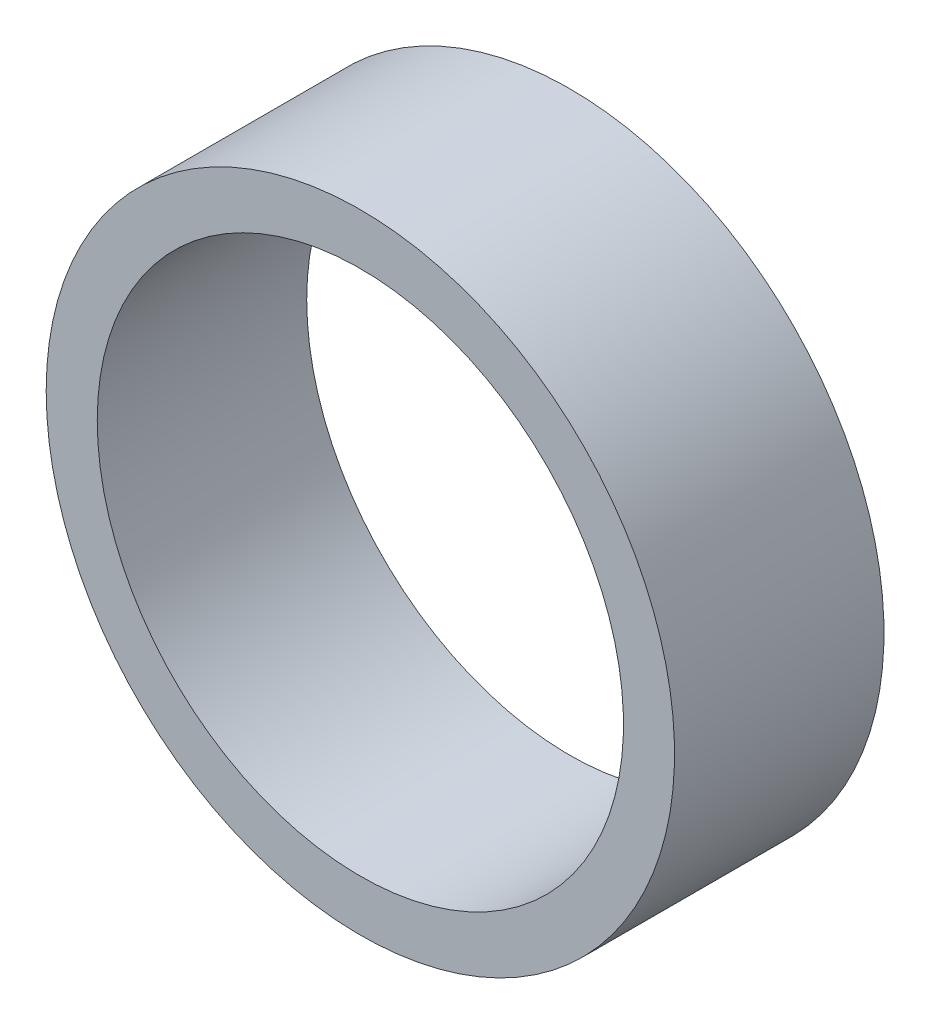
SolidWorks part; units mm, degrees
ref_plane "Front" through (0, 0, 0) normal (0, 0, 1) x (1, 0, 0)
ref_plane "Top" through (0, 0, 0) normal (0, 1, 0) x (1, 0, 0)
ref_plane "Right" through (0, 0, 0) normal (1, 0, 0) x (0, 0, -1)
sketch "Logo3_Revol_Axis" plane through (0, 0, 0) normal (0, 1, 0) x (1, 0, 0)
  line L0 (0, -30.1653) -> (0, 30.1653) construction
sketch "Logo3_bib1" plane through (0, 0, 0) normal (0, -1, 0) x (-1, 0, 0)
  line L0 (9.525, 0) -> (7.977, 0)
  line L1 (7.977, 0) -> (7.977, -6.35)
  line L2 (7.977, -6.35) -> (9.525, -6.35)
  line L3 (8.751, 0) -> (8.751, -6.35) construction
  line L4 (9.525, -6.35) -> (9.525, 0)
  line L5 (9.525, -3.175) -> (7.977, -3.175) construction
  line L10 (0, 38.9764) -> (0, -41.3764) construction
  point P11 (7.977, 0)
  point P15 (7.977, -6.35)
revolve "Revolve1" add sketch "Logo3_bib1" angle 360 about L10
equation "\"D2@Logo3_bib1\"=\"logo3_l1@Logo3_bib1\"/2"
equation "\"D3@Logo3_bib1\"=(\"logo3_d1@Logo3_bib1\"-\"logo3_d_in@Logo3_bib1\")/4"
